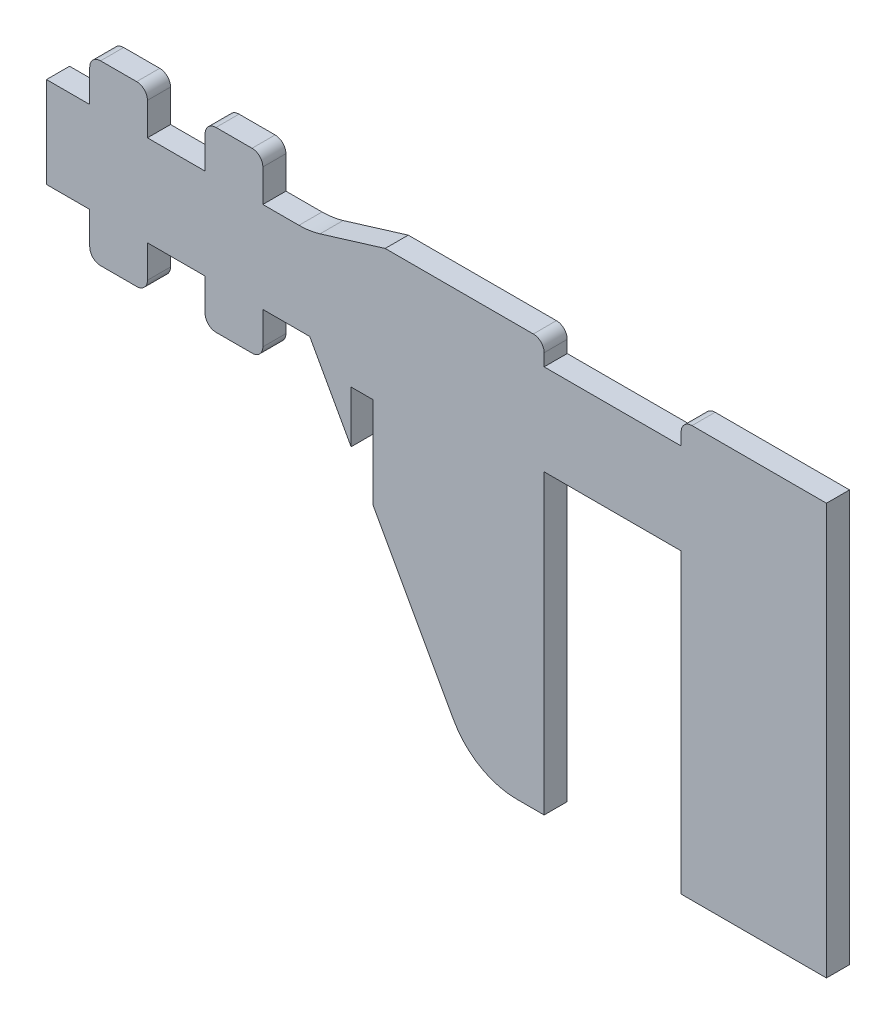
SolidWorks part; units mm, degrees
ref_plane "Plan de face" through (0, 0, 0) normal (0, 0, 1) x (1, 0, 0)
ref_plane "Plan de dessus" through (0, 0, 0) normal (0, 1, 0) x (1, 0, 0)
ref_plane "Plan de droite" through (0, 0, 0) normal (1, 0, 0) x (0, 0, -1)
sketch "Esquisse1" plane through (0, 0, 0) normal (0, 0, 1) x (1, 0, 0)
  line L0 (-28.2397, 0) -> (-22.2397, 0)
  line L1 (-22.2397, 0) -> (-22.2397, -6)
  line L2 (-22.2397, -6) -> (-14.2397, -6)
  line L3 (-14.2397, -6) -> (-14.2397, 0)
  line L4 (-14.2397, 0) -> (-6.2397, 0)
  line L5 (-6.2397, 0) -> (-6.2397, -6)
  line L6 (-6.2397, -6) -> (1.7603, -6)
  line L7 (1.7603, -6) -> (1.7603, 0)
  line L8 (1.7603, 0) -> (8.2603, 0)
  line L15 (79.8976, 34.518) -> (8.2603, 12.6)
  line L16 (8.2603, 12.6) -> (1.7603, 12.6)
  line L17 (1.7603, 12.6) -> (1.7603, 18.6)
  line L18 (1.7603, 18.6) -> (-6.2397, 18.6)
  line L19 (-6.2397, 18.6) -> (-6.2397, 12.6)
  line L20 (-6.2397, 12.6) -> (-14.2397, 12.6)
  line L21 (-14.2397, 12.6) -> (-14.2397, 18.6)
  line L22 (-14.2397, 18.6) -> (-22.2397, 18.6)
  line L23 (-22.2397, 18.6) -> (-22.2397, 12.6)
  line L24 (-22.2397, 12.6) -> (-28.2397, 12.6)
  line L25 (-28.2397, 12.6) -> (-28.2397, 0)
  line L35 (8.2603, 0) -> (31.0522, -41.2069)
  line L36 (31.0522, -41.2069) -> (79.8976, -41.2069)
  line L37 (79.8976, -41.2069) -> (79.8976, 34.518)
  dimension "D1" = 12.6
  dimension "D2" = 6
  dimension "D3" = 8
  dimension "D4" = 6
  dimension "D5" = 8
  dimension "D6" = 6.5
extrude "Boss.-Extru.1" add sketch "Esquisse1" along normal blind 3.2
sketch "Esquisse2" plane through (0, 0, 3.2) normal (0, 0, 1) x (1, 0, 0)
  line L1 (40.7575, 15.8) -> (59.7575, 15.8)
  line L2 (40.7575, 15.8) -> (40.7575, 12.6)
  line L3 (40.7575, 12.6) -> (59.7575, 12.6)
  line L4 (59.7575, 15.8) -> (59.7575, 12.6)
extrude "Enlèv. mat.-Extru.1" cut sketch "Esquisse2" against normal through all
fillet "Congé2" radius 10 1 edges at (8.2603, 12.6, 1.6)
sketch "Esquisse3" plane through (0, 0, 3.2) normal (0, 0, 1) x (1, 0, 0)
  line L1 (14, -43.2) -> (17, -43.2)
  line L2 (14, -43.2) -> (14, -3.2)
  line L3 (14, -3.2) -> (17, -3.2)
  line L4 (17, -43.2) -> (17, -3.2)
  line L5 (40.7575, -3.2) -> (59.7575, -3.2)
  line L6 (40.7575, -3.2) -> (40.7575, -53.2)
  line L7 (40.7575, -53.2) -> (59.7575, -53.2)
  line L8 (59.7575, -3.2) -> (59.7575, -53.2)
  line L11 (40.7575, 15.8) -> (40.7575, 12.6) construction
  dimension "D1" = 14
  dimension "D2" = 3
  dimension "D3" = 3.2
  dimension "D4" = 40
  dimension "D5" = 19
  dimension "D7" = 50
extrude "Enlèv. mat.-Extru.2" cut sketch "Esquisse3" against normal blind 10
fillet "Congé3" radius 10 2 edges at (31.0522, -41.2069, 1.6) (79.8976, 34.518, 1.6)
sketch "Esquisse4" plane through (0, 0, 3.2) normal (0, 0, 1) x (1, 0, 0)
  line L1 (40.7575, 0) -> (59.7575, 0)
  line L2 (40.7575, 0) -> (40.7575, -3.2)
  line L3 (40.7575, -3.2) -> (59.7575, -3.2)
  line L4 (59.7575, 0) -> (59.7575, -3.2)
extrude "Enlèv. mat.-Extru.3" cut sketch "Esquisse4" against normal blind 10
sketch "Esquisse5" plane through (0, 0, 0) normal (0, 0, -1) x (-1, 0, 0)
  line L0 (-40.7575, 15.8) -> (-9.9853, 15.8)
  line L1 (-6.7648, 15.8) -> (-40.7575, 15.8) construction
  line L2 (-9.9853, 15.8) -> (-16.7997, 40.929)
  line L3 (-16.7997, 40.929) -> (-90.5372, 47.0314)
  line L4 (-90.5372, 47.0314) -> (-94.7071, 13.9766)
  line L5 (-94.7071, 13.9766) -> (-79.8976, 15.8)
  line L6 (-79.8976, -41.2069) -> (-79.8976, 21.0008) construction
  line L7 (-79.8976, 15.8) -> (-59.7575, 15.8)
  line L8 (-59.7575, 15.8) -> (-59.7575, 12.6)
  line L9 (-59.7575, 12.6) -> (-40.7575, 12.6)
  line L10 (-40.7575, 15.8) -> (-40.7575, 12.6) construction
  line L11 (-40.7575, 12.6) -> (-59.7575, 12.6) construction
  line L12 (-40.7575, 12.6) -> (-40.7575, 15.8)
extrude "Enlèv. mat.-Extru.4" cut sketch "Esquisse5" against normal blind 10
fillet "Congé4" radius 1.5 10 edges at (59.7575, 15.8, 1.6) (40.7575, 15.8, 1.6) (1.7603, -6, 1.6) (-14.2397, -6, 1.6) (-6.2397, -6, 1.6) (-22.2397, -6, 1.6) (-22.2397, 18.6, 1.6) (-14.2397, 18.6, 1.6) (1.7603, 18.6, 1.6) (-6.2397, 18.6, 1.6)
